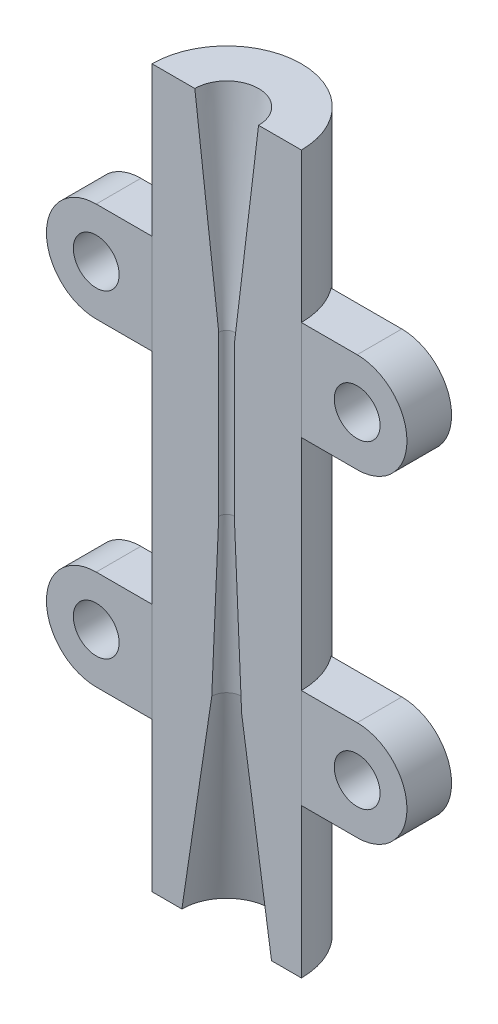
SolidWorks part; units mm, degrees
ref_plane "Front Plane" through (0, 0, 0) normal (0, 0, 1) x (1, 0, 0)
ref_plane "Top Plane" through (0, 0, 0) normal (0, 1, 0) x (1, 0, 0)
ref_plane "Right Plane" through (0, 0, 0) normal (1, 0, 0) x (0, 0, -1)
sketch "Sketch1" plane through (0, 0, 0) normal (0, 0, 1) x (1, 0, 0)
  line L0 (0, 0) -> (0, 8)
  line L1 (0, 8) -> (-1.2, 18)
  line L2 (0, 0) -> (-0.35, -8)
  line L3 (-0.35, -8) -> (-1.85, -18)
  line L4 (-1.85, -18) -> (-3.35, -18)
  line L5 (-3.35, -18) -> (-3.35, 18)
  line L8 (-1.2, 18) -> (0.4, 18)
  line L9 (0.4, 18) -> (0.4, -18)
  line L10 (0.4, -18) -> (-1.85, -18)
  line L11 (0, 0) -> (0.4, 0)
  line L12 (-0.35, -8) -> (0.4, -8)
  line L13 (-3.35, 18) -> (-1.2, 18)
  line L14 (-5.8006, -5.75) -> (-3.35, -5.75)
  line L15 (-5.8006, -10.25) -> (-3.35, -10.25)
  line L16 (-5.8048, 10.25) -> (-3.35, 10.25)
  line L17 (-5.8006, 5.75) -> (-3.35, 5.75)
  line L18 (-3.35, 10.25) -> (-3.35, 5.75)
  line L19 (-3.35, -5.75) -> (-3.35, -10.25)
  circle A1 centre (-5.8006, 8) radius 2.25
  circle A2 centre (-5.8006, -8) radius 2.25
  dimension "D10" = 4.5
  dimension "D11" = 4.5
  dimension "D1" = 8
  dimension "D2" = 0.4
  dimension "D3" = 0.75
  dimension "D4" = 8
  dimension "D5" = 10
  dimension "D6" = 10
  dimension "D7" = 1.6
  dimension "D8" = 2.25
  dimension "D9" = 1.5
revolve "Revolve1" add sketch "Sketch1" angle 180 about L9
sketch "Sketch2" plane through (0, 0, 0) normal (0, 0, 1) x (1, 0, 0)
  line L0 (-6.1503, 10.5) -> (-3.35, 10.5)
  line L1 (-3.35, -18) -> (-3.35, 18) construction
  line L2 (-6.1503, 5.5) -> (-3.35, 5.5)
  line L3 (-6.1503, -5.5) -> (-3.35, -5.5)
  line L4 (-6.1503, -10.5) -> (-3.35, -10.5)
  line L5 (6.95, 10.5) -> (4.15, 10.5)
  line L6 (4.15, -18) -> (4.15, 18) construction
  line L7 (6.95, -5.5) -> (4.15, -5.5)
  line L8 (6.95, 5.5) -> (4.15, 5.5)
  line L9 (6.95, -10.5) -> (4.15, -10.5)
  line L10 (4.15, 10.5) -> (4.15, 5.5)
  line L11 (4.15, -5.5) -> (4.15, -10.5)
  line L12 (-3.35, 10.5) -> (-1.85, 10.5)
  line L13 (-1.85, 10.5) -> (-1.85, 5.5)
  line L14 (-1.85, 5.5) -> (-3.35, 5.5)
  line L15 (4.15, 10.5) -> (2.65, 10.5)
  line L16 (2.65, 10.5) -> (2.65, 5.5)
  line L17 (2.65, 5.5) -> (4.15, 5.5)
  line L18 (-3.35, -5.5) -> (-1.85, -5.5)
  line L19 (-1.85, -5.5) -> (-1.85, -10.5)
  line L20 (-1.85, -10.5) -> (-3.35, -10.5)
  line L21 (4.15, -5.5) -> (2.65, -5.5)
  line L22 (2.65, -5.5) -> (2.65, -10.5)
  line L23 (2.65, -10.5) -> (4.15, -10.5)
  circle A0 centre (-6.1503, 8) radius 2.5
  circle A1 centre (-6.1503, -8) radius 2.5
  circle A2 centre (6.95, 8) radius 2.5
  circle A3 centre (6.95, -8) radius 2.5
  circle A4 centre (-6.1503, 8) radius 1.15
  circle A5 centre (6.95, 8) radius 1.15
  circle A6 centre (6.95, -8) radius 1.15
  circle A7 centre (-6.1503, -8) radius 1.15
  dimension "D1" = 5
  dimension "D2" = 5
  dimension "D4" = 5
  dimension "D6" = 5
  dimension "D8" = 2.3
  dimension "D9" = 2.3
  dimension "D10" = 2.3
  dimension "D11" = 2.3
  dimension "D3" = 2.8003
  dimension "D5" = 2.8
  dimension "D7" = 2.8
  dimension "D12" = 1.5
  dimension "D13" = 1.5
  dimension "D14" = 1.5
  dimension "D15" = 1.5
  dimension "D16" = 0
  dimension "D17" = 0
extrude "Boss-Extrude1" add sketch "Sketch2" against normal blind 2.24 separate body contours A0 L2 L0 M8 | A0 A4 | L14 L13 L12 M8 | A2 A5 | A2 L5 L10 L8 | L16 L17 L10 L15 | A3 L7 L11 L9 | L22 L23 L11 L21 | A3 A6 | L20 L19 L18 M8 | A1 L4 L3 M8 | A1 A7
fillet "Fillet1" [suppressed] radius 1
fillet "Fillet2" [suppressed] radius 1
fillet "Fillet3" [suppressed] radius 1
